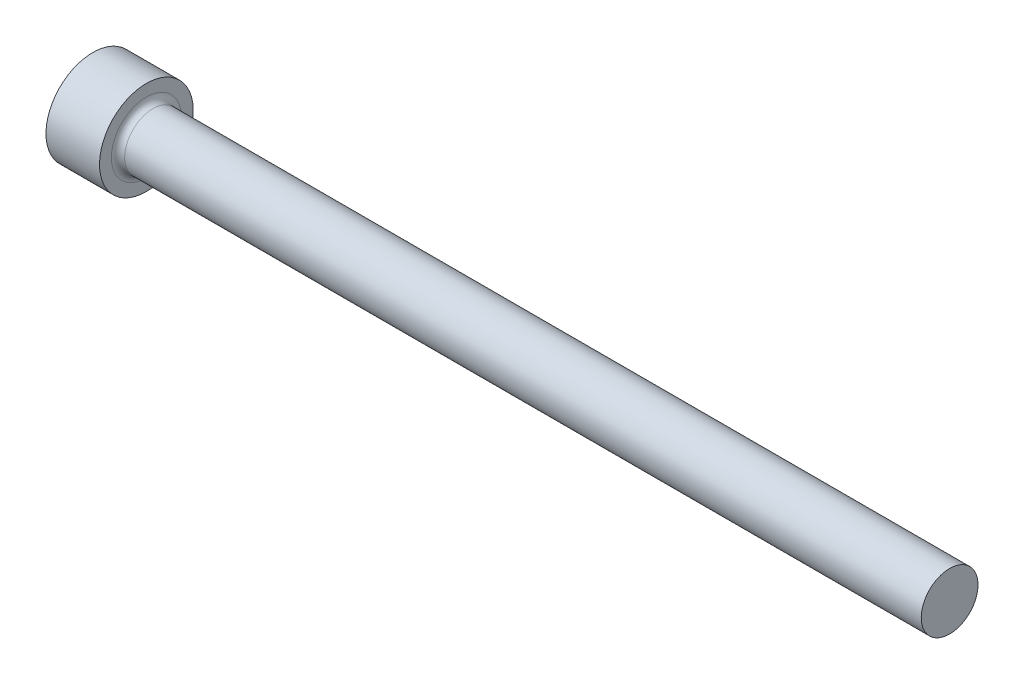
SolidWorks part; units mm, degrees
ref_plane "Front Plane" through (0, 0, 0) normal (0, 0, 1) x (1, 0, 0)
ref_plane "Top Plane" through (0, 0, 0) normal (0, 1, 0) x (1, 0, 0)
ref_plane "Right Plane" through (0, 0, 0) normal (1, 0, 0) x (0, 0, -1)
sketch "Sketch1" plane through (0, 0, 0) normal (0, 0, 1) x (1, 0, 0)
  line L0 (0, 0) -> (0, 5.5562)
  line L1 (0, 5.5562) -> (6.35, 5.5562)
  line L2 (6.35, 5.5562) -> (6.35, 4.1542)
  line L3 (7.1374, 3.3668) -> (101.6, 3.3668)
  line L4 (101.6, 3.3668) -> (101.6, 0)
  line L5 (101.6, 0) -> (0, 0)
  line L6 (101.6, 0) -> (0, 0) construction
  line L7 (0, 0) -> (-10.4771, 0) construction
  line L8 (101.6, 0) -> (1002.3976, 0) construction
  arc A0 (7.1374, 3.3668) -> (6.35, 4.1542) centre (7.1374, 4.1542) cw
  dimension "D1" = 0.7874
  dimension "HeadDia" = 11.1125
  dimension "HeadThickness" = 6.35
  dimension "PinDia" = 6.7335
  dimension "overall" = 101.6
revolve "PIN" add sketch "Sketch1" angle 360 about L6
